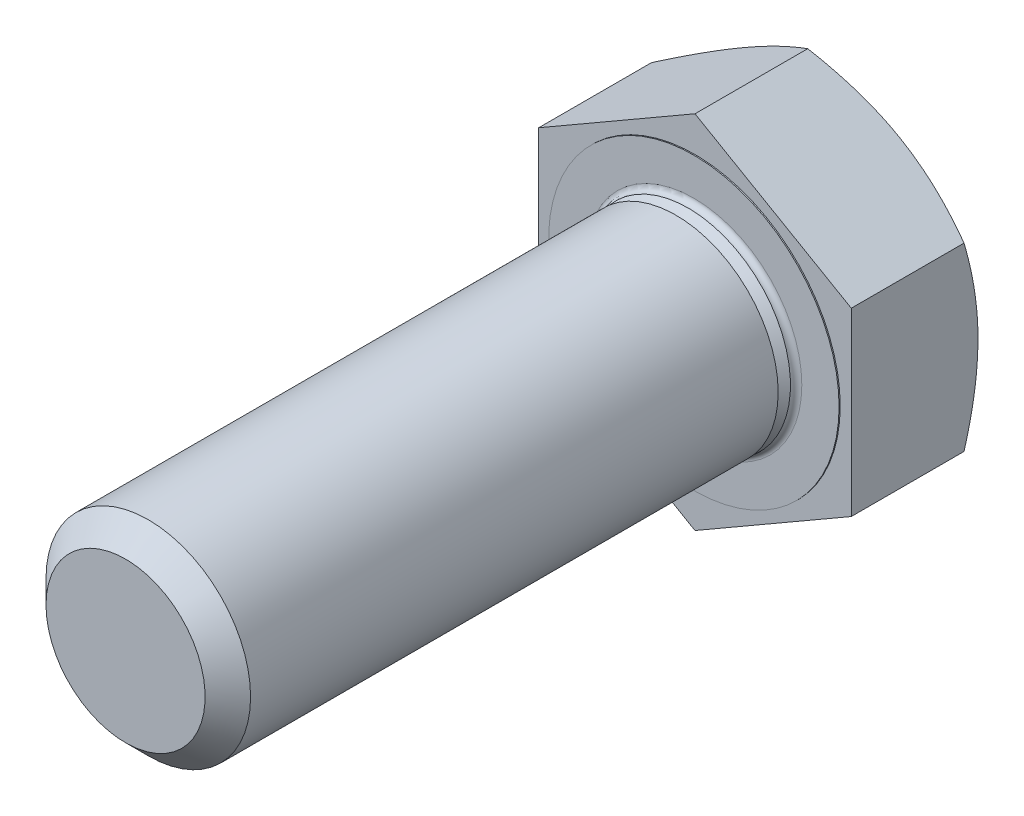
SolidWorks part; units mm, degrees
other "din_en_24017_m36x140"
ref_plane "Plan de face" through (0, 0, 0) normal (0, 0, 1) x (1, 0, 0)
ref_plane "Plan de dessus" through (0, 0, 0) normal (0, 1, 0) x (1, 0, 0)
ref_plane "Plan de droite" through (0, 0, 0) normal (1, 0, 0) x (0, 0, -1)
imported_body "Importée1"
sketch "Esquisse1" plane through (0, 0, 0) normal (1, 0, 0) x (0, 0, -1)
  line L0 (-140, 15.835) -> (-140, -15.835) construction
  line L1 (-150.1927, 31.6759) -> (-100, 31.6759)
  line L2 (-150.1927, 31.6759) -> (-150.1927, -28.6681)
  line L3 (-150.1927, -28.6681) -> (-100, -28.6681)
  line L4 (-100, 31.6759) -> (-100, -28.6681)
  dimension "D1" = 40
extrude "Enlèv. mat.-Extru.1" cut sketch "Esquisse1" against normal through all both and the other way through all
chamfer "Chanfrein1" distance 4 angle 45 1 edges at (-18, 0, 100)
